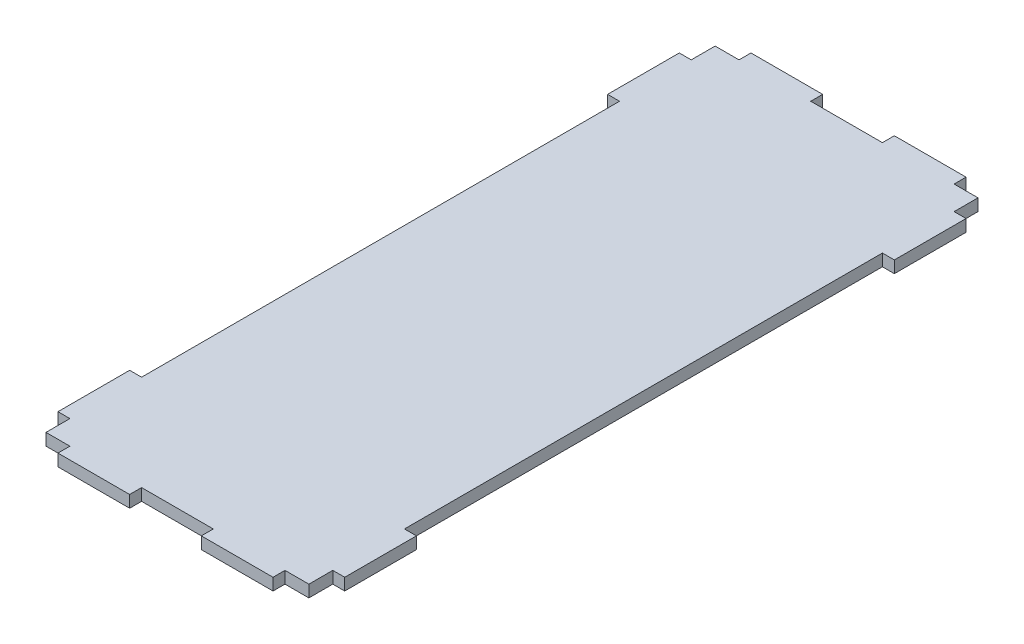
SolidWorks part; units mm, degrees
ref_plane "Front Plane" through (0, 0, 0) normal (0, 0, 1) x (1, 0, 0)
ref_plane "Top Plane" through (0, 0, 0) normal (0, 1, 0) x (1, 0, 0)
ref_plane "Right Plane" through (0, 0, 0) normal (1, 0, 0) x (0, 0, -1)
sketch "Sketch1" plane through (0, 0, 0) normal (0, 1, 0) x (1, 0, 0)
  line L0 (69.85, 0) -> (69.85, 177.8)
  line L1 (0, 0) -> (69.85, 0)
  line L2 (0, 0) -> (0, 177.8)
  line L3 (69.85, 177.8) -> (0, 177.8)
  dimension "D1" = 69.85
  dimension "D2" = 177.8
extrude "Boss-Extrude1" add sketch "Sketch1" along normal blind 3.175
sketch "Sketch2" plane through (0, 0, 0) normal (0, 1, 0) x (1, 0, 0)
  line L0 (69.85, 177.8) -> (0, 177.8) construction
  line L1 (63.5, 0) -> (44.45, 0)
  line L2 (44.45, 0) -> (44.45, -3.175)
  line L3 (63.5, -3.175) -> (44.45, -3.175)
  line L4 (63.5, 0) -> (63.5, -3.175)
  line L5 (34.925, 0) -> (34.925, 177.8) construction
  line L6 (0, 0) -> (69.85, 0) construction
  line L7 (6.35, 177.8) -> (25.4, 177.8)
  line L8 (25.4, 177.8) -> (25.4, 180.975)
  line L9 (6.35, 180.975) -> (25.4, 180.975)
  line L10 (0, 88.9) -> (69.85, 88.9) construction
  line L11 (0, 177.8) -> (0, 0) construction
  line L12 (69.85, 0) -> (69.85, 177.8) construction
  line L13 (6.35, 177.8) -> (6.35, 180.975)
  line L14 (63.5, 177.8) -> (63.5, 180.975)
  line L15 (63.5, 180.975) -> (44.45, 180.975)
  line L16 (6.35, 0) -> (6.35, -3.175)
  line L17 (6.35, -3.175) -> (25.4, -3.175)
  line L18 (25.4, 0) -> (25.4, -3.175)
  line L19 (44.45, 177.8) -> (44.45, 180.975)
  line L20 (63.5, 177.8) -> (44.45, 177.8)
  line L21 (6.35, 0) -> (25.4, 0)
  line L22 (-3.175, 6.35) -> (-3.175, 25.4)
  line L23 (0, 171.45) -> (-3.175, 171.45)
  line L24 (0, 171.45) -> (0, 152.4)
  line L25 (0, 152.4) -> (-3.175, 152.4)
  line L26 (-3.175, 171.45) -> (-3.175, 152.4)
  line L27 (0, 25.4) -> (-3.175, 25.4)
  line L28 (0, 6.35) -> (0, 25.4)
  line L29 (0, 6.35) -> (-3.175, 6.35)
  line L30 (69.85, 6.35) -> (73.025, 6.35)
  line L31 (69.85, 6.35) -> (69.85, 25.4)
  line L32 (69.85, 25.4) -> (73.025, 25.4)
  line L33 (73.025, 171.45) -> (73.025, 152.4)
  line L34 (69.85, 152.4) -> (73.025, 152.4)
  line L35 (69.85, 171.45) -> (69.85, 152.4)
  line L36 (69.85, 171.45) -> (73.025, 171.45)
  line L37 (73.025, 6.35) -> (73.025, 25.4)
  dimension "D1" = 19.05
  dimension "D2" = 3.175
  dimension "D3" = 6.35
  dimension "D4" = 19.05
  dimension "D5" = 3.175
  dimension "D6" = 6.35
extrude "Boss-Extrude2" add sketch "Sketch2" along normal blind 3.175
